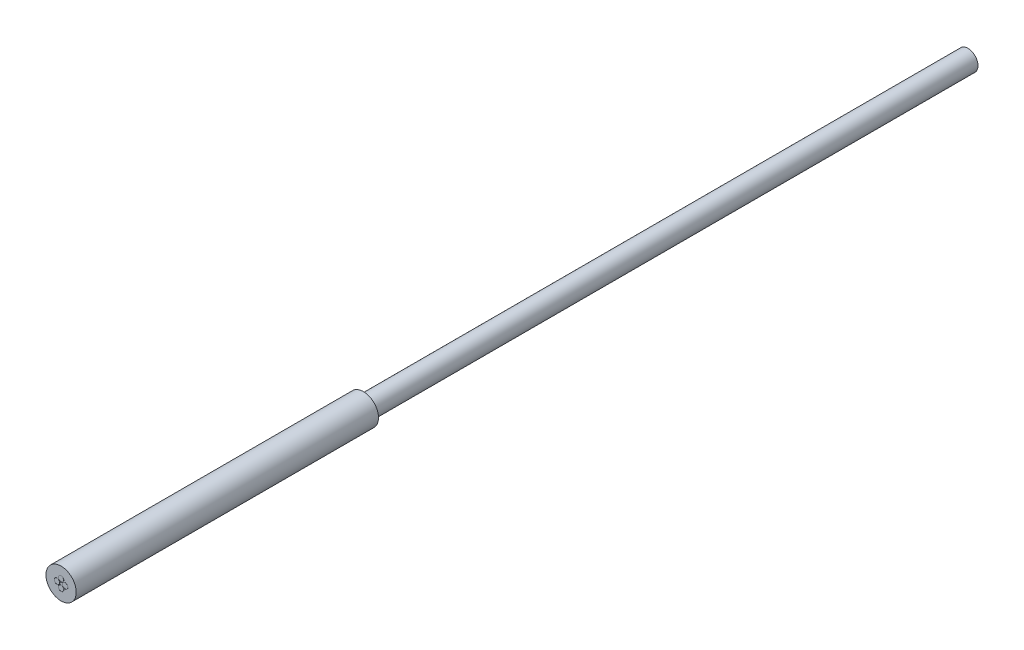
SolidWorks part; units mm, degrees
ref_plane "前视基准面" through (0, 0, 0) normal (0, 0, 1) x (1, 0, 0)
ref_plane "上视基准面" through (0, 0, 0) normal (0, 1, 0) x (1, 0, 0)
ref_plane "右视基准面" through (0, 0, 0) normal (1, 0, 0) x (0, 0, -1)
sketch "草图1" plane through (0, 0, 0) normal (0, 0, 1) x (1, 0, 0)
  circle A0 centre (0, 0) radius 0.75
  dimension "D1" = 1.5
extrude "凸台-拉伸1" add sketch "草图1" against normal blind 15
sketch "草图2" plane through (0, 0, -15) normal (0, 0, -1) x (-1, 0, 0)
  circle A0 centre (0, 0) radius 0.5
  dimension "D1" = 1
extrude "凸台-拉伸2" add sketch "草图2" along normal blind 30
sketch "草图3" plane through (0, 0, 0) normal (0, 0, 1) x (1, 0, 0)
  circle A0 centre (0, 0) radius 0.339 construction
  circle A1 centre (0, 0.2015) radius 0.1375
  circle A2 centre (0.2015, 0) radius 0.1375
  circle A3 centre (0, -0.2015) radius 0.1375
  circle A4 centre (-0.2015, 0) radius 0.1375
  circle A5 centre (0, 0.2015) radius 0.1325
  circle A6 centre (-0.2015, 0) radius 0.1325
  circle A7 centre (0, -0.2015) radius 0.1325
  circle A8 centre (0.2015, 0) radius 0.1325
  point P15 (0, 0)
  dimension "D1" = 0.275
  dimension "D2" = 0.265
  dimension "D3" = 0.01
extrude "切除-拉伸1" cut sketch "草图3" against normal blind 0.1
